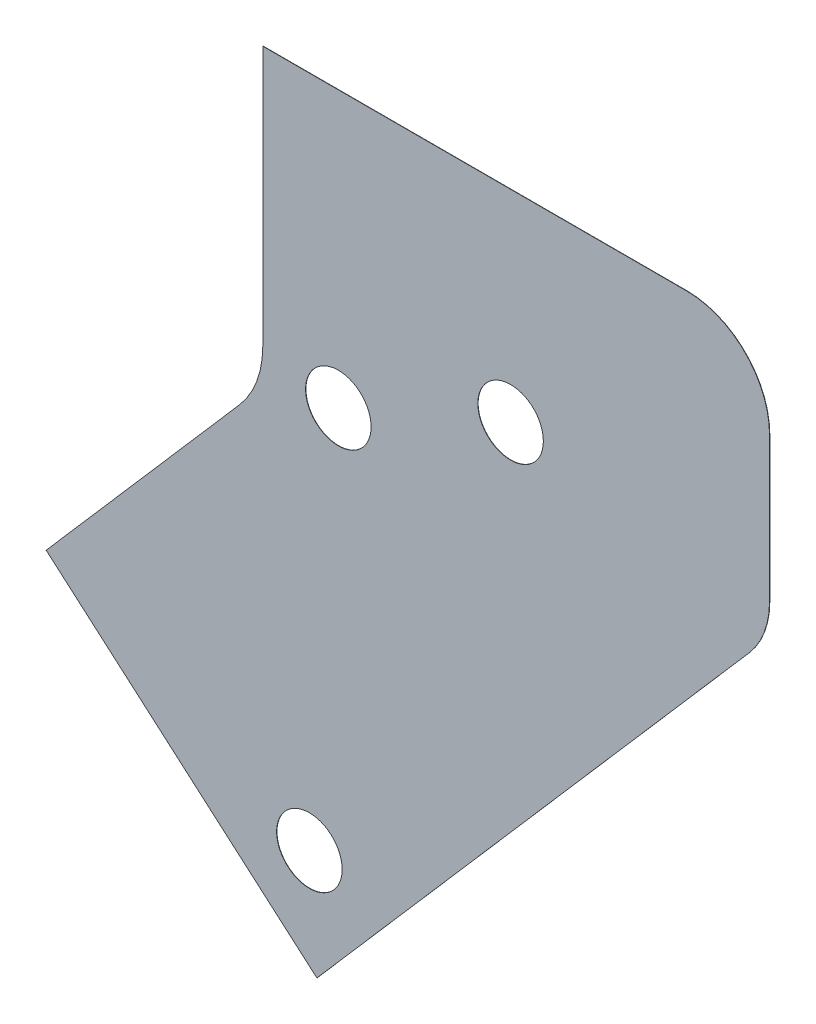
SolidWorks part; units mm, degrees
ref_plane "Front" through (0, 0, 0) normal (0, 0, 1) x (1, 0, 0)
ref_plane "Top" through (0, 0, 0) normal (0, 1, 0) x (1, 0, 0)
ref_plane "Right" through (0, 0, 0) normal (1, 0, 0) x (0, 0, -1)
sketch "Sketch1" plane through (0, 0, 0) normal (0, 0, 1) x (1, 0, 0)
  line L12 (-658.4279, -80.5573) -> (-621.3752, -37.891)
  line L13 (-619.633, -33.2277) -> (-619.633, -20.8199)
  line L14 (-626.745, -13.7079) -> (-663.067, -13.7079)
  line L15 (-663.067, -13.7079) -> (-663.067, -35.9898)
  line L16 (-665.0581, -41.3192) -> (-681.633, -60.4053)
  line L17 (-681.633, -60.4053) -> (-658.4279, -80.5573)
  line L18 (-658.4279, -80.5573) -> (-621.3752, -37.891)
  line L19 (-619.633, -33.2277) -> (-619.633, -20.8199)
  line L20 (-626.745, -13.7079) -> (-663.067, -13.7079)
  line L21 (-663.067, -13.7079) -> (-663.067, -35.9898)
  line L22 (-665.0581, -41.3192) -> (-681.633, -60.4053)
  line L23 (-681.633, -60.4053) -> (-658.4279, -80.5573)
  arc A6 (-621.3752, -37.891) -> (-619.633, -33.2277) centre (-626.745, -33.2277) ccw
  arc A7 (-619.633, -20.8199) -> (-626.745, -13.7079) centre (-626.745, -20.8199) ccw
  arc A8 (-665.0581, -41.3192) -> (-663.067, -35.9898) centre (-671.195, -35.9898) ccw
  arc A9 (-621.3752, -37.891) -> (-619.633, -33.2277) centre (-626.745, -33.2277) ccw
  arc A10 (-619.633, -20.8199) -> (-626.745, -13.7079) centre (-626.745, -20.8199) ccw
  arc A11 (-665.0581, -41.3192) -> (-663.067, -35.9898) centre (-671.195, -35.9898) ccw
  dimension "D1" = 0.508
extrude "Boss-Extrude1" add sketch "Sketch1" along normal blind 0.0254 separate body
hole_wizard "Hole1" positions "Point_Sketch" profile "Profil_Sketch" hole size "Ø0.15" standard "ISO"
sketch "Point_Sketch" plane through (-662.7256, -60.8189, 0.0254) normal (0, 0, -1) x (1, 0, 0)
  point P0 (3.6543, 10.6011)
  point P2 (6.1356, -23.4891)
  point P4 (20.8998, -29.8103)
sketch "Profil_Sketch" plane through (-659.0714, -71.4201, 0.0254) normal (1, 0, 0) x (0, -1, 0)
  line L0 (0, 0) -> (0, 0.0254)
  line L1 (0, 0.0254) -> (2.8067, 0.0254)
  line L2 (2.8067, 0.0254) -> (2.8067, 0)
  line L5 (2.8067, 0) -> (0, 0)
  line L11 (0, -6.35) -> (0, 107.95) construction
  dimension "Diameter" = 5.6134
  dimension "Thru Hole Depth" = 0.0254
other "usin_DL090_10-24x1.75-SHCS<1>"
